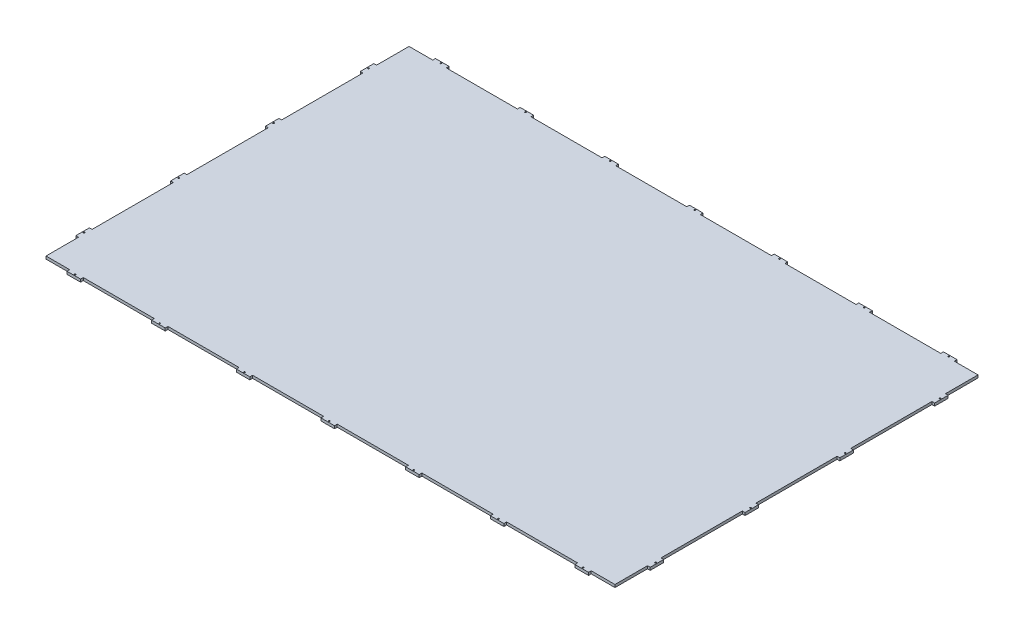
SolidWorks part; units mm, degrees
ref_plane "Ebene vorne" through (0, 0, 0) normal (0, 0, 1) x (1, 0, 0)
ref_plane "Ebene oben" through (0, 0, 0) normal (0, 1, 0) x (1, 0, 0)
ref_plane "Ebene rechts" through (0, 0, 0) normal (1, 0, 0) x (0, 0, -1)
sketch "Skizze1" plane through (0, 0, 0) normal (0, 1, 0) x (1, 0, 0)
  line L1 (-424, -272) -> (424, -272)
  line L2 (-424, -272) -> (-424, 272)
  line L3 (-424, 272) -> (424, 272)
  line L4 (424, -272) -> (424, 272)
  line L5 (-424, -272) -> (424, 272) construction
  line L6 (-424, 272) -> (424, -272) construction
  point P0 (0, 0)
  dimension "D1" = 848
  dimension "D2" = 544
extrude "Aufsatz-Linear austragen1" add sketch "Skizze1" along normal blind 4
sketch "Skizze2" plane through (0, 4, 0) normal (0, 1, 0) x (1, 0, 0)
  line L0 (-424, -272) -> (424, -272) construction
  line L1 (-424, -272) -> (-385, -272)
  line L2 (-424, -272) -> (-424, -268)
  line L3 (-424, -268) -> (-385, -268)
  line L4 (-385, -272) -> (-385, -268)
  line L5 (-365, -272) -> (-260, -272)
  line L6 (-365, -272) -> (-365, -268)
  line L7 (-365, -268) -> (-260, -268)
  line L8 (-260, -272) -> (-260, -268)
  line L9 (424, -272) -> (424, 272) construction
  line L10 (-240, -272) -> (-135, -272)
  line L11 (-240, -272) -> (-240, -268)
  line L12 (-240, -268) -> (-135, -268)
  line L13 (-135, -272) -> (-135, -268)
  line L14 (-115, -272) -> (-10, -272)
  line L15 (-115, -272) -> (-115, -268)
  line L16 (-115, -268) -> (-10, -268)
  line L17 (-10, -272) -> (-10, -268)
  line L18 (10, -272) -> (115, -272)
  line L19 (10, -272) -> (10, -268)
  line L20 (10, -268) -> (115, -268)
  line L21 (115, -272) -> (115, -268)
  line L22 (135, -272) -> (240, -272)
  line L23 (135, -272) -> (135, -268)
  line L24 (135, -268) -> (240, -268)
  line L25 (240, -272) -> (240, -268)
  line L26 (260, -272) -> (365, -272)
  line L27 (260, -272) -> (260, -268)
  line L28 (260, -268) -> (365, -268)
  line L29 (365, -272) -> (365, -268)
  line L30 (385, -272) -> (424, -272)
  line L31 (385, -272) -> (385, -268)
  line L32 (385, -268) -> (424, -268)
  line L33 (424, -272) -> (424, -268)
  line L34 (-385, -270) -> (-365, -270) construction
  line L35 (-260, -270) -> (-240, -270) construction
  line L36 (-135, -270) -> (-115, -270) construction
  line L37 (-10, -270) -> (10, -270) construction
  line L38 (115, -270) -> (135, -270) construction
  line L39 (240, -270) -> (260, -270) construction
  line L40 (365, -270) -> (385, -270) construction
  line L41 (0, -270) -> (0, 0) construction
  point P51 (-125, -270)
  point P52 (-250, -270)
  point P53 (-375, -270)
  point P54 (125, -270)
  point P55 (250, -270)
  point P56 (375, -270)
  dimension "D1" = 125
  dimension "D2" = 125
  dimension "D3" = 125
  dimension "D4" = 20
  dimension "D5" = 125
  dimension "D6" = 125
  dimension "D7" = 125
  dimension "D8" = 4
extrude "Schnitt-Linear austragen1" cut sketch "Skizze2" against normal through all
mirror "Spiegeln1" about plane through (0, 0, 0) normal (0, 0, 1) of "Schnitt-Linear austragen1"
sketch "Skizze3" plane through (0, 4, 0) normal (0, 1, 0) x (1, 0, 0)
  line L0 (-424, 268) -> (-424, -268) construction
  line L1 (-424, 268) -> (-420, 268)
  line L2 (-424, 268) -> (-424, 220)
  line L3 (-424, 220) -> (-420, 220)
  line L4 (-420, 268) -> (-420, 220)
  line L5 (-424, 200) -> (-420, 200)
  line L6 (-424, 200) -> (-424, 80)
  line L7 (-424, 80) -> (-420, 80)
  line L8 (-420, 200) -> (-420, 80)
  line L9 (-385, -268) -> (-424, -268) construction
  line L10 (-424, 60) -> (-420, 60)
  line L11 (-424, 60) -> (-424, -60)
  line L12 (-424, -60) -> (-420, -60)
  line L13 (-420, 60) -> (-420, -60)
  line L14 (-424, -80) -> (-420, -80)
  line L15 (-424, -80) -> (-424, -200)
  line L16 (-424, -200) -> (-420, -200)
  line L17 (-420, -80) -> (-420, -200)
  line L18 (-424, -220) -> (-420, -220)
  line L19 (-424, -220) -> (-424, -268)
  line L20 (-424, -268) -> (-420, -268)
  line L21 (-420, -220) -> (-420, -268)
  line L22 (-422, 220) -> (-422, 200) construction
  line L23 (-422, 80) -> (-422, 60) construction
  line L24 (-422, -60) -> (-422, -80) construction
  line L25 (-422, -200) -> (-422, -220) construction
  line L26 (-420, 0) -> (0, 0) construction
  point P36 (-422, 70)
  point P37 (-422, 210)
  point P39 (-422, -70)
  point P43 (-422, -210)
  dimension "D1" = 20
  dimension "D2" = 140
  dimension "D3" = 70
  dimension "D4" = 140
  dimension "D5" = 4
extrude "Schnitt-Linear austragen2" cut sketch "Skizze3" against normal through all
mirror "Spiegeln2" about plane through (0, 0, 0) normal (1, 0, 0) of "Schnitt-Linear austragen2"
hole_wizard "Ø2.0 (2) Durchmesser Bohrung1" positions "Skizze4" profile "Skizze5" hole size "Ø2.0" standard "DIN"
sketch "Skizze4" plane through (0, 4, 0) normal (0, 1, 0) x (1, 0, 0)
  line L0 (-424, 210) -> (-422, 210) construction
  line L1 (-424, 220) -> (-424, 200) construction
  line L3 (-424, 70) -> (-422, 70) construction
  line L4 (-424, 80) -> (-424, 60) construction
  line L6 (-424, -70) -> (-422, -70) construction
  line L7 (-424, -60) -> (-424, -80) construction
  line L9 (-424, -210) -> (-422, -210) construction
  line L10 (-424, -200) -> (-424, -220) construction
  line L12 (424, 200) -> (424, 220) construction
  line L13 (-375, 272) -> (-375, 270) construction
  line L14 (-365, 272) -> (-385, 272) construction
  line L16 (-250, 270) -> (-250, 272) construction
  line L17 (-240, 272) -> (-260, 272) construction
  line L19 (-125, 272) -> (-125, 270) construction
  line L20 (-115, 272) -> (-135, 272) construction
  line L22 (0, 270) -> (0, 272) construction
  line L23 (10, 272) -> (-10, 272) construction
  line L25 (125, 270) -> (125, 272) construction
  line L26 (135, 272) -> (115, 272) construction
  line L28 (250, 270) -> (250, 272) construction
  line L29 (260, 272) -> (240, 272) construction
  line L31 (375, 270) -> (375, 272) construction
  line L32 (385, 272) -> (365, 272) construction
  line L34 (365, -272) -> (385, -272) construction
  point P0 (-375, 270)
  point P2 (-250, 270)
  point P4 (-125, 270)
  point P6 (0, 270)
  point P8 (125, 270)
  point P10 (250, 270)
  point P12 (375, 270)
  point P14 (422, 210)
  point P16 (422, 70)
  point P18 (422, -70)
  point P20 (422, -210)
  point P22 (375, -270)
  point P24 (250, -270)
  point P26 (125, -270)
  point P28 (0, -270)
  point P30 (-125, -270)
  point P32 (-250, -270)
  point P34 (-375, -270)
  point P36 (-422, -210)
  point P38 (-422, -70)
  point P40 (-422, 70)
  point P42 (-422, 210)
  dimension "D1" = 2
  dimension "D2" = 2
  dimension "D3" = 2
  dimension "D4" = 2
sketch "Skizze5" plane through (-375, 4, -270) normal (1, 0, 0) x (0, 0, 1)
  line L0 (0, 0) -> (0, 4)
  line L1 (0, 4) -> (1, 4)
  line L2 (1, 4) -> (1, 0)
  line L5 (1, 0) -> (0, 0)
  line L11 (0, -6.35) -> (0, 107.95) construction
  dimension "Bohrerdurchmesser" = 2
  dimension "Bohrungstiefe" = 4
